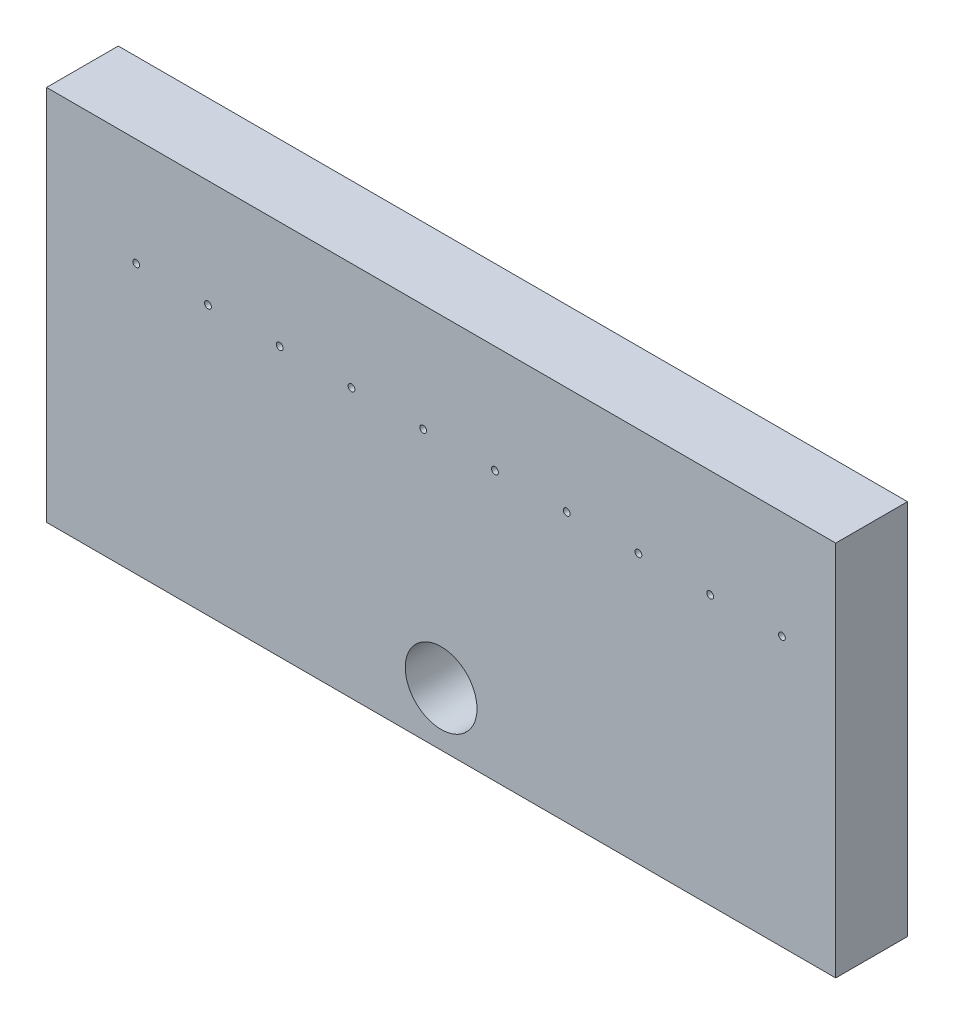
SolidWorks part; units mm, degrees
ref_plane "Front Plane" through (0, 0, 0) normal (0, 0, 1) x (1, 0, 0)
ref_plane "Top Plane" through (0, 0, 0) normal (0, 1, 0) x (1, 0, 0)
ref_plane "Right Plane" through (0, 0, 0) normal (1, 0, 0) x (0, 0, -1)
sketch "Sketch1" plane through (0, 0, 0) normal (0, 0, 1) x (1, 0, 0)
  line L1 (0, 0) -> (1117.6, 0)
  line L2 (0, 0) -> (0, 533.4)
  line L3 (0, 533.4) -> (1117.6, 533.4)
  line L4 (1117.6, 0) -> (1117.6, 533.4)
  dimension "D1" = 1117.6
  dimension "D2" = 533.4
extrude "Boss-Extrude1" add sketch "Sketch1" along normal blind 101.6
sketch "Sketch2" plane through (0, 0, 101.6) normal (0, 0, 1) x (1, 0, 0)
  line L1 (0, 533.4) -> (0, 0) construction
  line L2 (0, 0) -> (1117.6, 0) construction
  circle A0 centre (127, 381) radius 4.826
  dimension "D1" = 9.652
  dimension "D2" = 381
  dimension "D3" = 127
extrude "Cut-Extrude1" cut sketch "Sketch2" against normal blind 50.8
pattern_linear "LPattern1" count 10 spacing 101.6 along (1, 0, 0) of "Cut-Extrude1"
sketch "Sketch3" plane through (0, 0, 101.6) normal (0, 0, 1) x (1, 0, 0)
  line L0 (0, 0) -> (1117.6, 0) construction
  line L1 (1117.6, 0) -> (1117.6, 533.4) construction
  circle A0 centre (558.8, 76.2) radius 50.8
  dimension "D1" = 101.6
  dimension "D2" = 76.2
  dimension "D3" = 558.8
extrude "Cut-Extrude2" cut sketch "Sketch3" against normal through all
